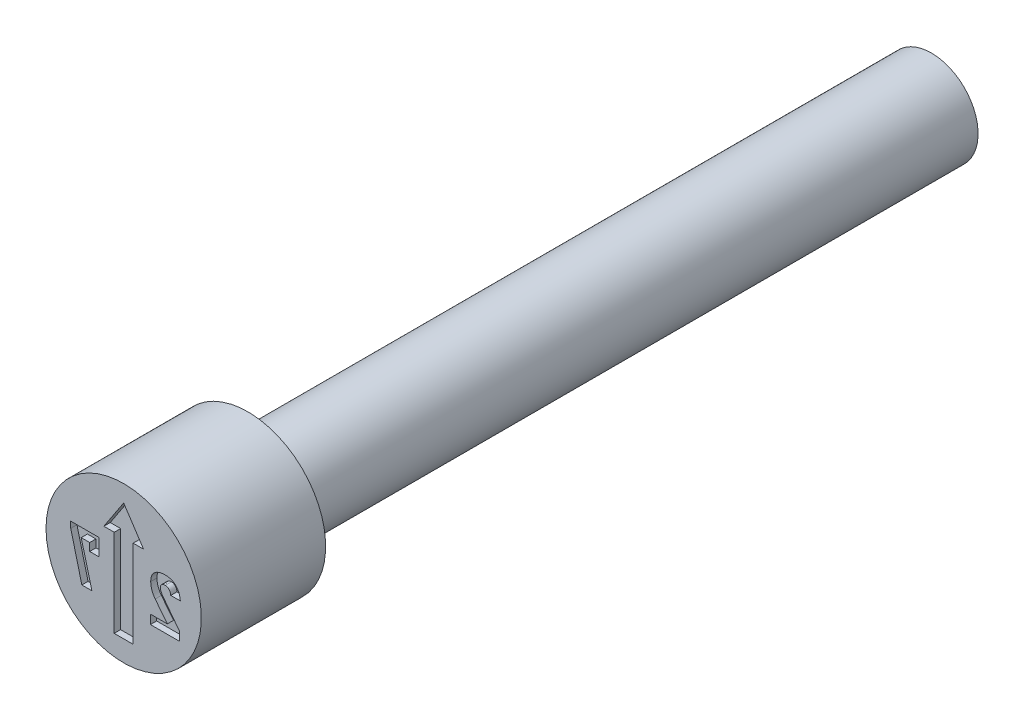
SolidWorks part; units mm, degrees
ref_plane "Front Plane" through (0, 0, 0) normal (0, 0, 1) x (1, 0, 0)
ref_plane "Top Plane" through (0, 0, 0) normal (0, 1, 0) x (1, 0, 0)
ref_plane "Right Plane" through (0, 0, 0) normal (1, 0, 0) x (0, 0, -1)
imported_body "Imported1"
sketch "Sketch1" plane through (0, 0, -0.2134) normal (0, 0, 1) x (1, 0, 0)
  line L7 (0.3192, 0.4953) -> (0, 0.9799)
  line L8 (0, 0.9799) -> (-0.3192, 0.4953)
  line L9 (-0.3192, 0.4953) -> (-0.1524, 0.4953)
  line L10 (-0.1524, 0.4953) -> (-0.1524, -0.9144)
  line L11 (-0.1524, -0.9144) -> (0.1524, -0.9144)
  line L12 (0.1524, -0.9144) -> (0.1524, 0.4953)
  line L13 (0.1524, 0.4953) -> (0.3192, 0.4953)
  line L14 (0.3192, 0.4953) -> (0, 0.9799)
  line L15 (0, 0.9799) -> (-0.3192, 0.4953)
  line L16 (-0.3192, 0.4953) -> (-0.1524, 0.4953)
  line L17 (-0.1524, 0.4953) -> (-0.1524, -0.9144)
  line L18 (-0.1524, -0.9144) -> (0.1524, -0.9144)
  line L19 (0.1524, -0.9144) -> (0.1524, 0.4953)
  line L20 (0.1524, 0.4953) -> (0.3192, 0.4953)
  dimension "D1" = 0
extrude "Boss-Extrude1" add sketch "Sketch1" along normal blind 0.11
sketch "Sketch2" plane through (0, 0, 0) normal (0, 0, 1) x (1, 0, 0)
  text T0 "2   7" font "Bahnschrift" height 0.8
  dimension "D2" = 0.5
extrude "Cut-Extrude1" cut sketch "Sketch2" against normal blind 0.1
